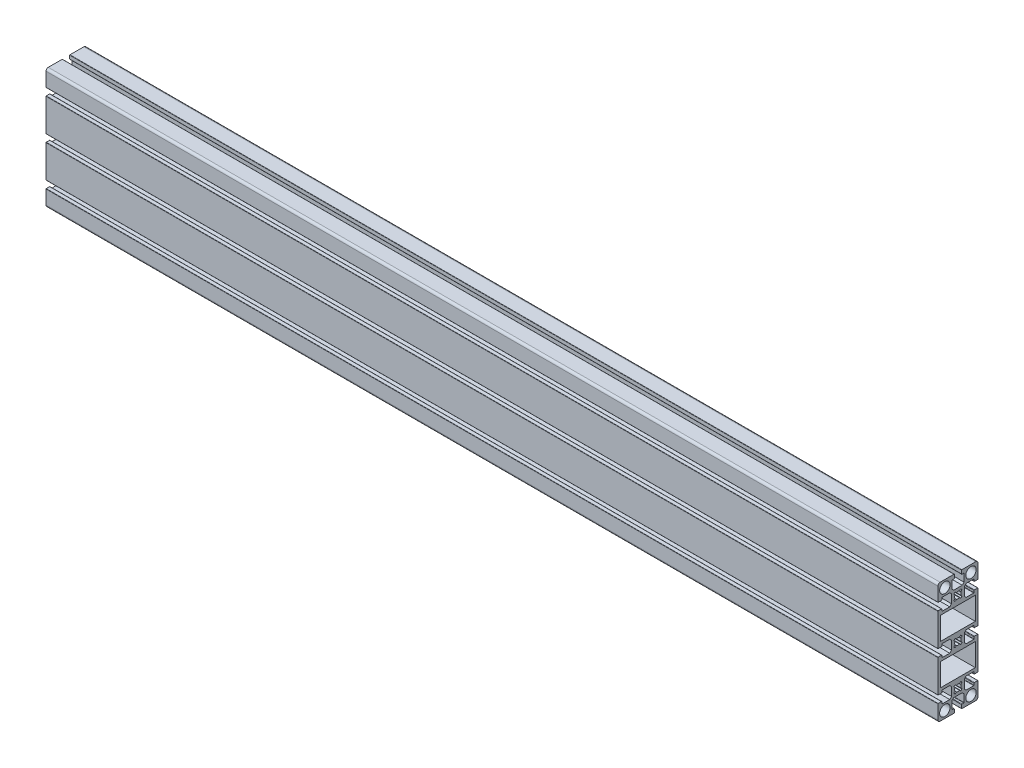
SolidWorks part; units mm, degrees
ref_plane "Front Plane" through (0, 0, 0) normal (0, 0, 1) x (1, 0, 0)
ref_plane "Top Plane" through (0, 0, 0) normal (0, 1, 0) x (1, 0, 0)
ref_plane "Right Plane" through (0, 0, 0) normal (1, 0, 0) x (0, 0, -1)
sketch "Sketch1" plane through (0, 0, 0) normal (0, 0, 1) x (1, 0, 0)
  line L0 (0, 0) -> (1000, 0)
  dimension "D1" = 1000
other "45-sarja 1.0052 45X135(1)"
ref_plane "Plane1" through (0, 0, 0) normal (1, 0, 0) x (0, 0, -1)
sketch "Model12" plane through (0, 0, 0) normal (1, 0, 0) x (0, 0, -1)
  line L0 (4.3841, 48.3941) -> (3.3941, 49.3841)
  line L1 (2.9698, 49.3841) -> (1.9491, 48.3633)
  line L2 (-1.9491, 48.3633) -> (-2.9698, 49.3841)
  line L3 (-3.3941, 49.3841) -> (-4.3841, 48.3941)
  line L4 (-4.3841, 47.9698) -> (-3.3633, 46.9491)
  line L5 (-3.3633, 43.0509) -> (-4.3841, 42.0302)
  line L6 (-4.3841, 41.6059) -> (-3.3941, 40.6159)
  line L7 (-2.9698, 40.6159) -> (-1.9491, 41.6367)
  line L8 (1.9491, 41.6367) -> (2.9698, 40.6159)
  line L9 (3.3941, 40.6159) -> (4.3841, 41.6059)
  line L10 (4.3841, 42.0302) -> (3.3633, 43.0509)
  line L11 (3.3633, 46.9491) -> (4.3841, 47.9698)
  line L12 (19.5, 35.2) -> (-19.5, 35.2)
  line L13 (-19.5, 35.2) -> (-19.5, 9.8)
  line L14 (-19.5, 9.8) -> (19.5, 9.8)
  line L15 (19.5, 9.8) -> (19.5, 35.2)
  line L16 (4.3841, 3.3941) -> (3.3941, 4.3841)
  line L17 (2.9698, 4.3841) -> (1.9491, 3.3633)
  line L18 (-1.9491, 3.3633) -> (-2.9698, 4.3841)
  line L19 (-3.3941, 4.3841) -> (-4.3841, 3.3941)
  line L20 (-4.3841, 2.9698) -> (-3.3633, 1.9491)
  line L21 (-3.3633, -1.9491) -> (-4.3841, -2.9698)
  line L22 (-4.3841, -3.3941) -> (-3.3941, -4.3841)
  line L23 (-2.9698, -4.3841) -> (-1.9491, -3.3633)
  line L24 (1.9491, -3.3633) -> (2.9698, -4.3841)
  line L25 (3.3941, -4.3841) -> (4.3841, -3.3941)
  line L26 (4.3841, -2.9698) -> (3.3633, -1.9491)
  line L27 (3.3633, 1.9491) -> (4.3841, 2.9698)
  line L28 (19.5, -9.8) -> (-19.5, -9.8)
  line L29 (-19.5, -9.8) -> (-19.5, -35.2)
  line L30 (-19.5, -35.2) -> (19.5, -35.2)
  line L31 (19.5, -35.2) -> (19.5, -9.8)
  line L32 (3.3633, -43.0509) -> (4.3841, -42.0302)
  line L33 (4.3841, -41.6059) -> (3.3941, -40.6159)
  line L34 (2.9698, -40.6159) -> (1.9491, -41.6367)
  line L35 (-1.9491, -41.6367) -> (-2.9698, -40.6159)
  line L36 (-3.3941, -40.6159) -> (-4.3841, -41.6059)
  line L37 (-4.3841, -42.0302) -> (-3.3633, -43.0509)
  line L38 (-3.3633, -46.9491) -> (-4.3841, -47.9698)
  line L39 (-4.3841, -48.3941) -> (-3.3941, -49.3841)
  line L40 (-2.9698, -49.3841) -> (-1.9491, -48.3633)
  line L41 (1.9491, -48.3633) -> (2.9698, -49.3841)
  line L42 (3.3941, -49.3841) -> (4.3841, -48.3941)
  line L43 (4.3841, -47.9698) -> (3.3633, -46.9491)
  line L44 (-18.5, 40.9) -> (-22.2, 40.9)
  line L45 (-18, 38.5) -> (-18, 40.4)
  line L46 (-9.2, 38.2) -> (-17.7, 38.2)
  line L47 (-7.2, 40.2) -> (-9.2, 38.2)
  line L48 (-7.2, 49.8) -> (-7.2, 40.2)
  line L49 (-9.2, 51.8) -> (-7.2, 49.8)
  line L50 (-17.7, 51.8) -> (-9.2, 51.8)
  line L51 (-18, 49.6) -> (-18, 51.5)
  line L52 (-22.2, 49.1) -> (-18.5, 49.1)
  line L53 (-22.5, 65) -> (-22.5, 49.4)
  line L54 (-4.4, 67.5) -> (-20, 67.5)
  line L55 (-4.1, 63.5) -> (-4.1, 67.2)
  line L56 (-6.5, 63) -> (-4.6, 63)
  line L57 (-6.8, 54.2) -> (-6.8, 62.7)
  line L58 (-4.8, 52.2) -> (-6.8, 54.2)
  line L59 (4.8, 52.2) -> (-4.8, 52.2)
  line L60 (6.8, 54.2) -> (4.8, 52.2)
  line L61 (6.8, 62.7) -> (6.8, 54.2)
  line L62 (4.6, 63) -> (6.5, 63)
  line L63 (4.1, 67.2) -> (4.1, 63.5)
  line L64 (20, 67.5) -> (4.4, 67.5)
  line L65 (22.5, 49.4) -> (22.5, 65)
  line L66 (18.5, 49.1) -> (22.2, 49.1)
  line L67 (18, 51.5) -> (18, 49.6)
  line L68 (9.2, 51.8) -> (17.7, 51.8)
  line L69 (7.2, 49.8) -> (9.2, 51.8)
  line L70 (7.2, 40.2) -> (7.2, 49.8)
  line L71 (9.2, 38.2) -> (7.2, 40.2)
  line L72 (17.7, 38.2) -> (9.2, 38.2)
  line L73 (18, 40.4) -> (18, 38.5)
  line L74 (22.2, 40.9) -> (18.5, 40.9)
  line L75 (22.5, 4.4) -> (22.5, 40.6)
  line L76 (18.5, 4.1) -> (22.2, 4.1)
  line L77 (18, 6.5) -> (18, 4.6)
  line L78 (9.2, 6.8) -> (17.7, 6.8)
  line L79 (7.2, 4.8) -> (9.2, 6.8)
  line L80 (7.2, -4.8) -> (7.2, 4.8)
  line L81 (9.2, -6.8) -> (7.2, -4.8)
  line L82 (17.7, -6.8) -> (9.2, -6.8)
  line L83 (18, -4.6) -> (18, -6.5)
  line L84 (22.2, -4.1) -> (18.5, -4.1)
  line L85 (22.5, -40.6) -> (22.5, -4.4)
  line L86 (18.5, -40.9) -> (22.2, -40.9)
  line L87 (18, -38.5) -> (18, -40.4)
  line L88 (9.2, -38.2) -> (17.7, -38.2)
  line L89 (7.2, -40.2) -> (9.2, -38.2)
  line L90 (7.2, -49.8) -> (7.2, -40.2)
  line L91 (9.2, -51.8) -> (7.2, -49.8)
  line L92 (17.7, -51.8) -> (9.2, -51.8)
  line L93 (18, -49.6) -> (18, -51.5)
  line L94 (22.2, -49.1) -> (18.5, -49.1)
  line L95 (22.5, -65) -> (22.5, -49.4)
  line L96 (4.4, -67.5) -> (20, -67.5)
  line L97 (4.1, -63.5) -> (4.1, -67.2)
  line L98 (6.5, -63) -> (4.6, -63)
  line L99 (6.8, -54.2) -> (6.8, -62.7)
  line L100 (4.8, -52.2) -> (6.8, -54.2)
  line L101 (-4.8, -52.2) -> (4.8, -52.2)
  line L102 (-6.8, -54.2) -> (-4.8, -52.2)
  line L103 (-6.8, -62.7) -> (-6.8, -54.2)
  line L104 (-4.6, -63) -> (-6.5, -63)
  line L105 (-4.1, -67.2) -> (-4.1, -63.5)
  line L106 (-20, -67.5) -> (-4.4, -67.5)
  line L107 (-22.5, -49.4) -> (-22.5, -65)
  line L108 (-18.5, -49.1) -> (-22.2, -49.1)
  line L109 (-18, -51.5) -> (-18, -49.6)
  line L110 (-9.2, -51.8) -> (-17.7, -51.8)
  line L111 (-7.2, -49.8) -> (-9.2, -51.8)
  line L112 (-7.2, -40.2) -> (-7.2, -49.8)
  line L113 (-9.2, -38.2) -> (-7.2, -40.2)
  line L114 (-17.7, -38.2) -> (-9.2, -38.2)
  line L115 (-18, -40.4) -> (-18, -38.5)
  line L116 (-22.2, -40.9) -> (-18.5, -40.9)
  line L117 (-22.5, -4.4) -> (-22.5, -40.6)
  line L118 (-18.5, -4.1) -> (-22.2, -4.1)
  line L119 (-18, -6.5) -> (-18, -4.6)
  line L120 (-9.2, -6.8) -> (-17.7, -6.8)
  line L121 (-7.2, -4.8) -> (-9.2, -6.8)
  line L122 (-7.2, 4.8) -> (-7.2, -4.8)
  line L123 (-9.2, 6.8) -> (-7.2, 4.8)
  line L124 (-17.7, 6.8) -> (-9.2, 6.8)
  line L125 (-18, 4.6) -> (-18, 6.5)
  line L126 (-22.2, 4.1) -> (-18.5, 4.1)
  line L127 (-22.5, 40.6) -> (-22.5, 4.4)
  circle A0 centre (-14.65, 59.65) radius 5.85
  arc A1 (4.3841, 47.9698) -> (4.3841, 48.3941) centre (4.1719, 48.182) ccw
  arc A2 (3.3941, 49.3841) -> (2.9698, 49.3841) centre (3.182, 49.1719) ccw
  arc A3 (1.6059, 48.3056) -> (1.9491, 48.3633) centre (1.7369, 48.5754) ccw
  arc A4 (1.6059, 48.3056) -> (-1.6059, 48.3056) centre (0, 45) ccw
  arc A5 (-1.9491, 48.3633) -> (-1.6059, 48.3056) centre (-1.7369, 48.5754) ccw
  arc A6 (-2.9698, 49.3841) -> (-3.3941, 49.3841) centre (-3.182, 49.1719) ccw
  arc A7 (-4.3841, 48.3941) -> (-4.3841, 47.9698) centre (-4.1719, 48.182) ccw
  arc A8 (-3.3056, 46.6059) -> (-3.3633, 46.9491) centre (-3.5754, 46.7369) ccw
  arc A9 (-3.3056, 46.6059) -> (-3.3056, 43.3941) centre (0, 45) ccw
  arc A10 (-3.3633, 43.0509) -> (-3.3056, 43.3941) centre (-3.5754, 43.2631) ccw
  arc A11 (-4.3841, 42.0302) -> (-4.3841, 41.6059) centre (-4.1719, 41.818) ccw
  arc A12 (-3.3941, 40.6159) -> (-2.9698, 40.6159) centre (-3.182, 40.8281) ccw
  arc A13 (-1.6059, 41.6944) -> (-1.9491, 41.6367) centre (-1.7369, 41.4246) ccw
  arc A14 (-1.6059, 41.6944) -> (1.6059, 41.6944) centre (0, 45) ccw
  arc A15 (1.9491, 41.6367) -> (1.6059, 41.6944) centre (1.7369, 41.4246) ccw
  arc A16 (2.9698, 40.6159) -> (3.3941, 40.6159) centre (3.182, 40.8281) ccw
  arc A17 (4.3841, 41.6059) -> (4.3841, 42.0302) centre (4.1719, 41.818) ccw
  arc A18 (3.3056, 43.3941) -> (3.3633, 43.0509) centre (3.5754, 43.2631) ccw
  arc A19 (3.3056, 43.3941) -> (3.3056, 46.6059) centre (0, 45) ccw
  arc A20 (3.3633, 46.9491) -> (3.3056, 46.6059) centre (3.5754, 46.7369) ccw
  arc A21 (4.3841, 2.9698) -> (4.3841, 3.3941) centre (4.1719, 3.182) ccw
  arc A22 (3.3941, 4.3841) -> (2.9698, 4.3841) centre (3.182, 4.1719) ccw
  arc A23 (1.6059, 3.3056) -> (1.9491, 3.3633) centre (1.7369, 3.5754) ccw
  arc A24 (1.6059, 3.3056) -> (-1.6059, 3.3056) centre (0, 0) ccw
  arc A25 (-1.9491, 3.3633) -> (-1.6059, 3.3056) centre (-1.7369, 3.5754) ccw
  arc A26 (-2.9698, 4.3841) -> (-3.3941, 4.3841) centre (-3.182, 4.1719) ccw
  arc A27 (-4.3841, 3.3941) -> (-4.3841, 2.9698) centre (-4.1719, 3.182) ccw
  arc A28 (-3.3056, 1.6059) -> (-3.3633, 1.9491) centre (-3.5754, 1.7369) ccw
  arc A29 (-3.3056, 1.6059) -> (-3.3056, -1.6059) centre (0, 0) ccw
  arc A30 (-3.3633, -1.9491) -> (-3.3056, -1.6059) centre (-3.5754, -1.7369) ccw
  arc A31 (-4.3841, -2.9698) -> (-4.3841, -3.3941) centre (-4.1719, -3.182) ccw
  arc A32 (-3.3941, -4.3841) -> (-2.9698, -4.3841) centre (-3.182, -4.1719) ccw
  arc A33 (-1.6059, -3.3056) -> (-1.9491, -3.3633) centre (-1.7369, -3.5754) ccw
  arc A34 (-1.6059, -3.3056) -> (1.6059, -3.3056) centre (0, 0) ccw
  arc A35 (1.9491, -3.3633) -> (1.6059, -3.3056) centre (1.7369, -3.5754) ccw
  arc A36 (2.9698, -4.3841) -> (3.3941, -4.3841) centre (3.182, -4.1719) ccw
  arc A37 (4.3841, -3.3941) -> (4.3841, -2.9698) centre (4.1719, -3.182) ccw
  arc A38 (3.3056, -1.6059) -> (3.3633, -1.9491) centre (3.5754, -1.7369) ccw
  arc A39 (3.3056, -1.6059) -> (3.3056, 1.6059) centre (0, 0) ccw
  arc A40 (3.3633, 1.9491) -> (3.3056, 1.6059) centre (3.5754, 1.7369) ccw
  arc A41 (4.3841, -42.0302) -> (4.3841, -41.6059) centre (4.1719, -41.818) ccw
  arc A42 (3.3941, -40.6159) -> (2.9698, -40.6159) centre (3.182, -40.8281) ccw
  arc A43 (1.6059, -41.6944) -> (1.9491, -41.6367) centre (1.7369, -41.4246) ccw
  arc A44 (1.6059, -41.6944) -> (-1.6059, -41.6944) centre (0, -45) ccw
  arc A45 (-1.9491, -41.6367) -> (-1.6059, -41.6944) centre (-1.7369, -41.4246) ccw
  arc A46 (-2.9698, -40.6159) -> (-3.3941, -40.6159) centre (-3.182, -40.8281) ccw
  arc A47 (-4.3841, -41.6059) -> (-4.3841, -42.0302) centre (-4.1719, -41.818) ccw
  arc A48 (-3.3056, -43.3941) -> (-3.3633, -43.0509) centre (-3.5754, -43.2631) ccw
  arc A49 (-3.3056, -43.3941) -> (-3.3056, -46.6059) centre (0, -45) ccw
  arc A50 (-3.3633, -46.9491) -> (-3.3056, -46.6059) centre (-3.5754, -46.7369) ccw
  arc A51 (-4.3841, -47.9698) -> (-4.3841, -48.3941) centre (-4.1719, -48.182) ccw
  arc A52 (-3.3941, -49.3841) -> (-2.9698, -49.3841) centre (-3.182, -49.1719) ccw
  arc A53 (-1.6059, -48.3056) -> (-1.9491, -48.3633) centre (-1.7369, -48.5754) ccw
  arc A54 (-1.6059, -48.3056) -> (1.6059, -48.3056) centre (0, -45) ccw
  arc A55 (1.9491, -48.3633) -> (1.6059, -48.3056) centre (1.7369, -48.5754) ccw
  arc A56 (2.9698, -49.3841) -> (3.3941, -49.3841) centre (3.182, -49.1719) ccw
  arc A57 (4.3841, -48.3941) -> (4.3841, -47.9698) centre (4.1719, -48.182) ccw
  arc A58 (3.3056, -46.6059) -> (3.3633, -46.9491) centre (3.5754, -46.7369) ccw
  arc A59 (3.3056, -46.6059) -> (3.3056, -43.3941) centre (0, -45) ccw
  arc A60 (3.3633, -43.0509) -> (3.3056, -43.3941) centre (3.5754, -43.2631) ccw
  circle A61 centre (14.65, -59.65) radius 5.85
  arc A62 (-18, 40.4) -> (-18.5, 40.9) centre (-18.5, 40.4) ccw
  arc A63 (-18, 38.5) -> (-17.7, 38.2) centre (-17.7, 38.5) ccw
  arc A64 (-17.7, 51.8) -> (-18, 51.5) centre (-17.7, 51.5) ccw
  arc A65 (-18.5, 49.1) -> (-18, 49.6) centre (-18.5, 49.6) ccw
  arc A66 (-22.5, 49.4) -> (-22.2, 49.1) centre (-22.2, 49.4) ccw
  arc A67 (-20, 67.5) -> (-22.5, 65) centre (-20, 65) ccw
  arc A68 (-4.1, 67.2) -> (-4.4, 67.5) centre (-4.4, 67.2) ccw
  arc A69 (-4.6, 63) -> (-4.1, 63.5) centre (-4.6, 63.5) ccw
  arc A70 (-6.5, 63) -> (-6.8, 62.7) centre (-6.5, 62.7) ccw
  arc A71 (6.8, 62.7) -> (6.5, 63) centre (6.5, 62.7) ccw
  arc A72 (4.1, 63.5) -> (4.6, 63) centre (4.6, 63.5) ccw
  arc A73 (4.4, 67.5) -> (4.1, 67.2) centre (4.4, 67.2) ccw
  arc A74 (22.5, 65) -> (20, 67.5) centre (20, 65) ccw
  arc A75 (22.2, 49.1) -> (22.5, 49.4) centre (22.2, 49.4) ccw
  arc A76 (18, 49.6) -> (18.5, 49.1) centre (18.5, 49.6) ccw
  arc A77 (18, 51.5) -> (17.7, 51.8) centre (17.7, 51.5) ccw
  arc A78 (17.7, 38.2) -> (18, 38.5) centre (17.7, 38.5) ccw
  arc A79 (18.5, 40.9) -> (18, 40.4) centre (18.5, 40.4) ccw
  arc A80 (22.5, 40.6) -> (22.2, 40.9) centre (22.2, 40.6) ccw
  arc A81 (22.2, 4.1) -> (22.5, 4.4) centre (22.2, 4.4) ccw
  arc A82 (18, 4.6) -> (18.5, 4.1) centre (18.5, 4.6) ccw
  arc A83 (18, 6.5) -> (17.7, 6.8) centre (17.7, 6.5) ccw
  arc A84 (17.7, -6.8) -> (18, -6.5) centre (17.7, -6.5) ccw
  arc A85 (18.5, -4.1) -> (18, -4.6) centre (18.5, -4.6) ccw
  arc A86 (22.5, -4.4) -> (22.2, -4.1) centre (22.2, -4.4) ccw
  arc A87 (22.2, -40.9) -> (22.5, -40.6) centre (22.2, -40.6) ccw
  arc A88 (18, -40.4) -> (18.5, -40.9) centre (18.5, -40.4) ccw
  arc A89 (18, -38.5) -> (17.7, -38.2) centre (17.7, -38.5) ccw
  arc A90 (17.7, -51.8) -> (18, -51.5) centre (17.7, -51.5) ccw
  arc A91 (18.5, -49.1) -> (18, -49.6) centre (18.5, -49.6) ccw
  arc A92 (22.5, -49.4) -> (22.2, -49.1) centre (22.2, -49.4) ccw
  arc A93 (20, -67.5) -> (22.5, -65) centre (20, -65) ccw
  arc A94 (4.1, -67.2) -> (4.4, -67.5) centre (4.4, -67.2) ccw
  arc A95 (4.6, -63) -> (4.1, -63.5) centre (4.6, -63.5) ccw
  arc A96 (6.5, -63) -> (6.8, -62.7) centre (6.5, -62.7) ccw
  arc A97 (-6.8, -62.7) -> (-6.5, -63) centre (-6.5, -62.7) ccw
  arc A98 (-4.1, -63.5) -> (-4.6, -63) centre (-4.6, -63.5) ccw
  arc A99 (-4.4, -67.5) -> (-4.1, -67.2) centre (-4.4, -67.2) ccw
  arc A100 (-22.5, -65) -> (-20, -67.5) centre (-20, -65) ccw
  arc A101 (-22.2, -49.1) -> (-22.5, -49.4) centre (-22.2, -49.4) ccw
  arc A102 (-18, -49.6) -> (-18.5, -49.1) centre (-18.5, -49.6) ccw
  arc A103 (-18, -51.5) -> (-17.7, -51.8) centre (-17.7, -51.5) ccw
  arc A104 (-17.7, -38.2) -> (-18, -38.5) centre (-17.7, -38.5) ccw
  arc A105 (-18.5, -40.9) -> (-18, -40.4) centre (-18.5, -40.4) ccw
  arc A106 (-22.5, -40.6) -> (-22.2, -40.9) centre (-22.2, -40.6) ccw
  arc A107 (-22.2, -4.1) -> (-22.5, -4.4) centre (-22.2, -4.4) ccw
  arc A108 (-18, -4.6) -> (-18.5, -4.1) centre (-18.5, -4.6) ccw
  arc A109 (-18, -6.5) -> (-17.7, -6.8) centre (-17.7, -6.5) ccw
  arc A110 (-17.7, 6.8) -> (-18, 6.5) centre (-17.7, 6.5) ccw
  arc A111 (-18.5, 4.1) -> (-18, 4.6) centre (-18.5, 4.6) ccw
  arc A112 (-22.5, 4.4) -> (-22.2, 4.1) centre (-22.2, 4.4) ccw
  arc A113 (-22.2, 40.9) -> (-22.5, 40.6) centre (-22.2, 40.6) ccw
  circle A114 centre (-14.65, -59.65) radius 5.85
  circle A115 centre (14.65, 59.65) radius 5.85
  point P351 (0, 0)
  point P352 (0, 45)
  point P353 (0, 0)
  point P354 (0, -45)
  point P355 (-22.5, 67.5)
  point P356 (22.5, 67.5)
  point P357 (22.5, -67.5)
  point P358 (-22.5, -67.5)
  point P359 (-22.5, 0)
  point P360 (22.5, 0)
  point P361 (0, 0)
